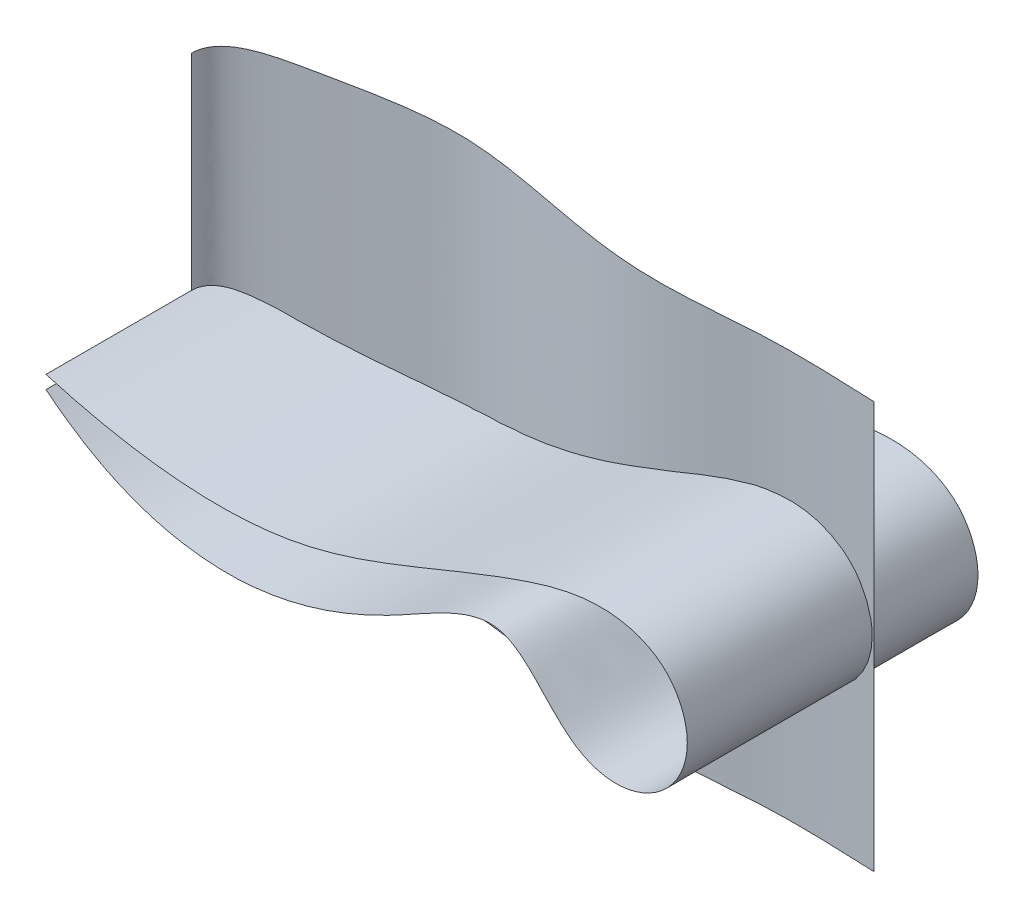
SolidWorks part; units mm, degrees
ref_plane "Front Plane" through (0, 0, 0) normal (0, 0, 1) x (1, 0, 0)
ref_plane "Top Plane" through (0, 0, 0) normal (0, 1, 0) x (1, 0, 0)
ref_plane "Right Plane" through (0, 0, 0) normal (1, 0, 0) x (0, 0, -1)
sketch "size reference sketch" plane through (0, 0, 0) normal (0, 0, 1) x (1, 0, 0)
  line L0 (-127, 11.1717) -> (-127, -17.3428)
  circle A0 centre (0, 0) radius 15.875
  circle A1 centre (0, 0) radius 17.653
  circle A2 centre (0, 0) radius 6.6675
  dimension "D1" = 31.75
  dimension "D2" = 13.335
  dimension "D3" = 1.778
sketch "side profile" plane through (0, 0, 0) normal (0, 0, 1) x (1, 0, 0)
  line L0 (-127, 11.1717) -> (-127, -17.3428) construction
  circle A0 centre (0, 0) radius 15.875 construction
  spline S0 degree 3 poles (-127, -0.4292) (-108.2959, -5.8821) (-71.2681, -10.5825) (-32.9362, 9.8201) (-2.5951, 18.4688) (12.3051, 12.5299) (17.4516, 0.3071) (13.134, -11.1263) (2.7745, -16.9671) (-8.1967, -15.0165) (-17.5031, -5.1327) (-27.5434, 5.2683) (-58.7948, -15.3297) (-91.6914, -22.4612) (-116.3332, -11.9966) (-127, -3.374) knots 0 0 0 0 0.176221 0.342733 0.413344 0.452056 0.490325 0.525387 0.558963 0.594536 0.625672 0.667697 0.737834 0.886996 1 1 1 1
sketch "Sketch3" plane through (0, 0, 0) normal (0, 1, 0) x (1, 0, 0)
  line L0 (0, 0) -> (0, 25.3958) construction
  line L1 (-127, -154.9463) -> (-127, -151.6228) construction
  line L2 (0, 0) -> (-134.053, 0) construction
  spline S0 degree 3 poles (16.3176, 8.807) (6.8465, 9.2102) (-4.0036, 9.6722) (-22.1088, 8.1484) (-44.6647, 6.8463) (-77.3156, 17) (-103.8484, 11.5016) (-127, 6.6358) (-127, 0) knots 0 0 0 0 0.193206 0.221335 0.370943 0.655973 0.869382 1 1 1 1
surface "Surface-Extrude1" sketch "side profile" parameters "D1"=64.77
surface "Surface-Extrude2" sketch "Sketch3" parameters "D1"=90.678
sketch3d "3DSketch1"
  spline S0 degree 3 number of poles 212 (-127, -0.4292, 0) -> (-127, -3.374, 0)
  spline S1 degree 3 number of poles 212 (-127, -0.4292, 0) -> (-127, -3.374, 0)
